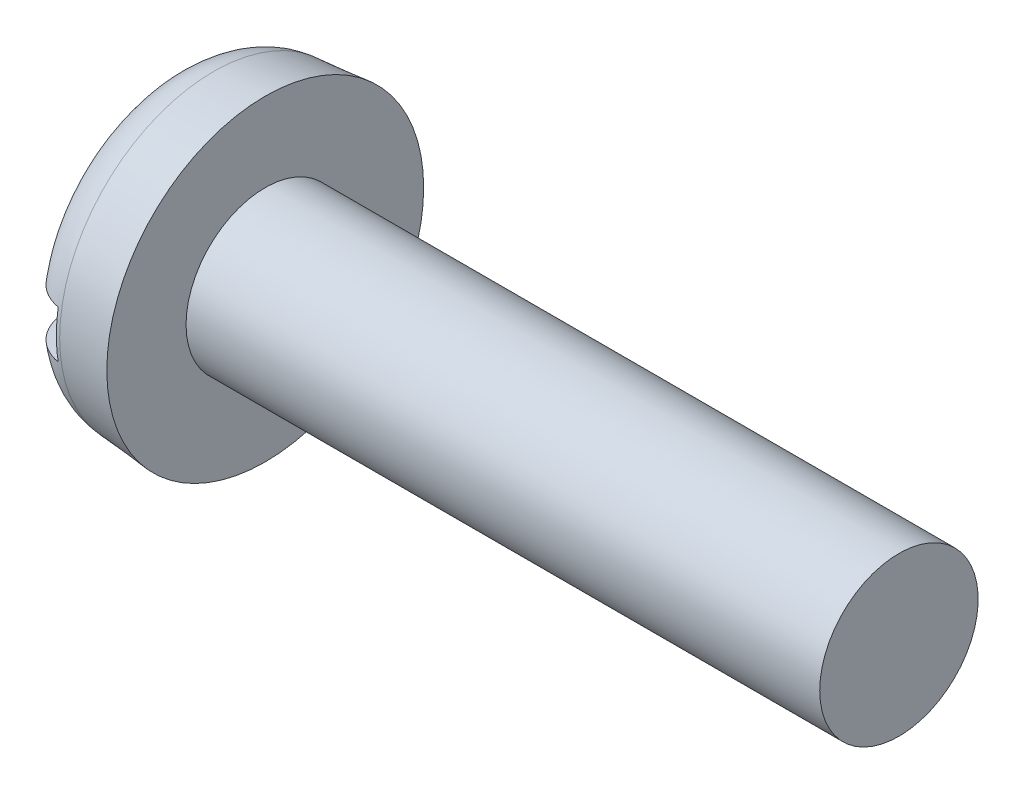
SolidWorks part; units mm, degrees
ref_plane "Plane1" through (0, 0, 0) normal (0, 0, 1) x (1, 0, 0)
ref_plane "Plane2" through (0, 0, 0) normal (0, 1, 0) x (1, 0, 0)
ref_plane "Plane3" through (0, 0, 0) normal (1, 0, 0) x (0, 0, -1)
sketch "BodySke" plane through (0, 0, 0) normal (0, 0, 1) x (1, 0, 0)
  line L0 (2.4, 2) -> (2.4, 4)
  line L1 (0, 0) -> (0, 3.79)
  line L2 (-25.4, 0) -> (127, 0) construction
  line L3 (18.4, 0) -> (0, 0)
  line L4 (2.4, 2) -> (18.4, 2)
  line L5 (18.4, 2) -> (18.4, 0)
  line L6 (0, 3.79) -> (2.4, 4)
  line L9 (3.1, 3.5875) -> (3.1, -5.9375) construction
  line L10 (2.4, 6.35) -> (2.4, -3.175) construction
revolve "Base-Revolve" add sketch "BodySke"
fillet "Fillet1" [suppressed] radius 0.2
fillet "Fillet2" radius 1.2 1 edges at (0, 0, 3.79)
sketch "Sketch2" plane through (0, 0, 0) normal (1, 0, 0) x (0, 0, -1)
  line L0 (4, -0.6) -> (-4, -0.6)
  line L1 (4, -0.6) -> (4, 0.6)
  line L2 (-4, 0.6) -> (4, 0.6)
  line L3 (-4, 0.6) -> (-4, -0.6)
extrude "Slot" cut sketch "Sketch2" along normal blind 1
sketch "ThdSchSke" plane through (0, 0, 0) normal (0, 0, 1) x (1, 0, 0)
  line L0 (3.8, -1.61) -> (3.5269, -2)
  line L1 (3.8, -1.61) -> (4.0731, -2)
  line L2 (4.0731, -2) -> (4.0731, -2.5)
  line L3 (-3.175, 0) -> (5.1513, 0) construction
  line L5 (4.0731, -2.5) -> (3.5269, -2.5)
  line L6 (3.5269, -2.5) -> (3.5269, -2)
revolve "ThreadSchematic" [suppressed] cut sketch "ThdSchSke" angle 360 about L3
pattern_linear "ThdSchPat" [suppressed]
equation "\"D1@Sketch2\" = \"Head_dia@BodySke\""
equation "\"D2@Sketch2\" = \"D1@Sketch2\" / 2"
equation "\"D3@Sketch2\" = \"Slot_width@Sketch2\" / 2"
equation "\"Thread_length@ThreadCosmetic\" = ((sgn( (\"Length@BodySke\" - \"Advance@BodySke\" * 2.0 ) - \"Thread_nom@BodySke\" )-1)*( (\"Length@BodySke\" - \"Advance@BodySke\"  * 2.0) - \"Thread_nom@BodySke\" ))/-2+ \"Thread_"
equation "\"Thread_minor@ThdSchSke\" = \"Thread_minor@ThreadCosmetic\""
equation "\"Diameter@ThdSchSke\" = \"Diameter@BodySke\""
equation "\"Overcut@ThdSchSke\" = \"Diameter@BodySke\" * 1.25"
equation "\"Start@ThdSchSke\" = \"Head_ht@BodySke\" + \"Length@BodySke\" - \"Thread_length@ThreadCosmetic\"  '---Non-countersunk---"
equation "\"Num_threads@ThdSchPat\" = int( \"Thread_length@ThreadCosmetic\" / \"Advance@BodySke\" + 0.999 )  + 1"
equation "\"Advance@ThdSchPat\" = \"Thread_length@ThreadCosmetic\" /  (\"Num_threads@ThdSchPat\" - 1) 'relax it"
